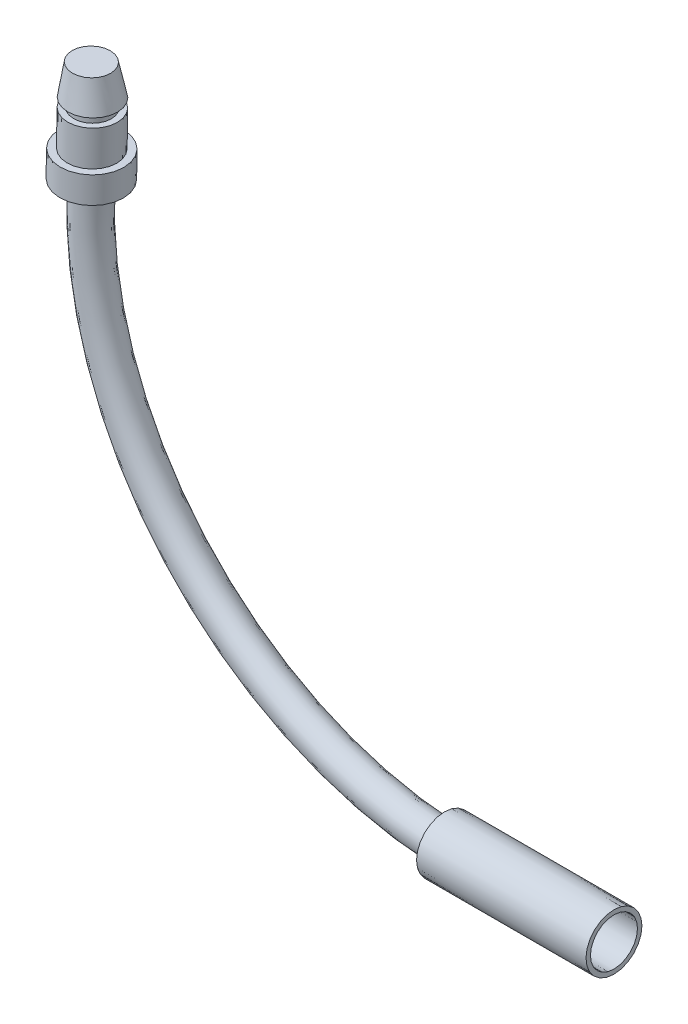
SolidWorks part; units mm, degrees
ref_plane "Plan1" through (0, 0, 0) normal (0, 0, 1) x (1, 0, 0)
ref_plane "Plan2" through (0, 0, 0) normal (0, 1, 0) x (1, 0, 0)
ref_plane "Plan3" through (0, 0, 0) normal (1, 0, 0) x (0, 0, -1)
sketch "Esquisse1" plane through (0, 0, 0) normal (0, 0, 1) x (1, 0, 0)
  line L0 (44.7803, 249.8848) -> (44.7803, 262.4305)
  line L1 (44.7803, 256.1576) -> (6.2122, 256.1576) construction
  line L2 (-72.9723, 368.4528) -> (-72.9723, 345.7166) construction
  line L3 (6.2122, 256.1576) -> (6.2122, 291.3172) construction
  line L101 (6.2122, 252.3722) -> (6.075, 249.8848)
  line L102 (6.075, 249.8848) -> (44.7803, 249.8848)
  line L103 (44.7803, 249.8848) -> (44.7803, 262.4305)
  line L104 (44.7803, 262.4305) -> (6.2308, 262.4305)
  line L105 (6.2308, 262.4305) -> (6.2308, 259.8578)
  line L106 (-69.0809, 345.7681) -> (-65.1403, 345.5081)
  line L107 (-65.1403, 345.5081) -> (-64.7676, 351.1565)
  line L108 (-64.7676, 351.1565) -> (-66.3762, 351.2626)
  line L109 (-66.3762, 351.2626) -> (-65.8721, 358.9033)
  line L110 (-77.4066, 345.7166) -> (-80.1555, 345.7166)
  line L111 (-80.1555, 345.7166) -> (-80.1555, 351.6899)
  line L112 (-80.1555, 351.6899) -> (-78.4794, 351.6899)
  line L113 (-78.4794, 351.6899) -> (-78.4794, 359.735)
  line L114 (-78.4794, 359.735) -> (-65.8721, 358.9033)
  line L115 (-78.2698, 362.5048) -> (-65.6817, 361.7901)
  line L116 (-65.6817, 361.7901) -> (-67.92, 368.4528)
  line L117 (-78.2698, 362.5048) -> (-75.6299, 368.4528)
  line L118 (-75.6299, 368.4528) -> (-67.92, 368.4528)
  arc A0 (-72.9723, 345.7166) -> (6.2122, 256.1576) centre (11.3994, 340.5294) ccw
  arc A33 (-69.0809, 345.7681) -> (6.2308, 259.8578) centre (11.5104, 340.4516) ccw
  arc A34 (-77.4066, 345.7166) -> (6.2122, 252.3722) centre (11.0912, 340.8683) ccw
  arc A35 (-65.8721, 358.9033) -> (-65.6817, 361.7901) centre (-65.571, 360.3331) cw
  arc A36 (-78.4794, 359.735) -> (-78.2698, 362.5048) centre (-78.8945, 361.1593) ccw
ref_plane "Plan5" through (6.2122, 0, 0) normal (1, 0, 0) x (0, 0, -1)
sketch "Esquisse2" plane through (6.2122, 0, 0) normal (1, 0, 0) x (0, 0, -1)
  circle A0 centre (0, 256.1576) radius 3.7855
sketch "Esquisse7" plane through (0, 0, 0) normal (0, 0, 1) x (1, 0, 0)
  arc A0 (6.2122, 256.1576) -> (-72.9723, 345.7166) centre (10.6822, 339.8952) cw
sweep "Base-Balayage" add profiles "Esquisse2" path "Esquisse7"
sketch "Esquisse8" plane through (6.2122, 0, 0) normal (1, 0, 0) x (0, 0, -1)
  circle A0 centre (0, 256.1576) radius 6.2729
extrude "Boss.-Extru.1" add sketch "Esquisse8" along normal blind 38
sketch "Esquisse9" plane through (5.5621, 344.4485, 0) normal (0.0161, 0.9999, 0) x (-0.9999, 0.0161, 0)
  circle A0 centre (78.5447, 0) radius 7.1822
extrude "Boss.-Extru.2" add sketch "Esquisse9" along normal blind 6
sketch "Esquisse10" plane through (5.659, 350.4477, 0) normal (0.0161, 0.9999, 0) x (-0.9999, 0.0161, 0)
  circle A0 centre (78.5447, 0) radius 5.6028
extrude "Boss.-Extru.3" add sketch "Esquisse10" along normal blind 8
sketch "Esquisse11" plane through (5.7881, 358.4467, 0) normal (0.0161, 0.9999, 0) x (-0.9999, 0.0161, 0)
  circle A0 centre (78.5447, 0) radius 4.2599
extrude "Boss.-Extru.4" add sketch "Esquisse11" along normal blind 2
sketch "Esquisse12" plane through (5.8204, 360.4464, 0) normal (0.0161, 0.9999, 0) x (-0.9999, 0.0161, 0)
  circle A0 centre (78.5447, 0) radius 5.6028
ref_plane "Plan6" through (5.9292, 367.1788, 0) normal (0.0161, 0.9999, 0) x (-0.9999, 0.0161, 0)
sketch "Esquisse13" plane through (5.9292, 367.1788, 0) normal (0.0161, 0.9999, 0) x (-0.9999, 0.0161, 0)
  circle A0 centre (78.9118, 0) radius 4.3082
loft "Boss.-Lissage1" add profiles "Esquisse12", "Esquisse13"
shell "Coque1" thickness 1
